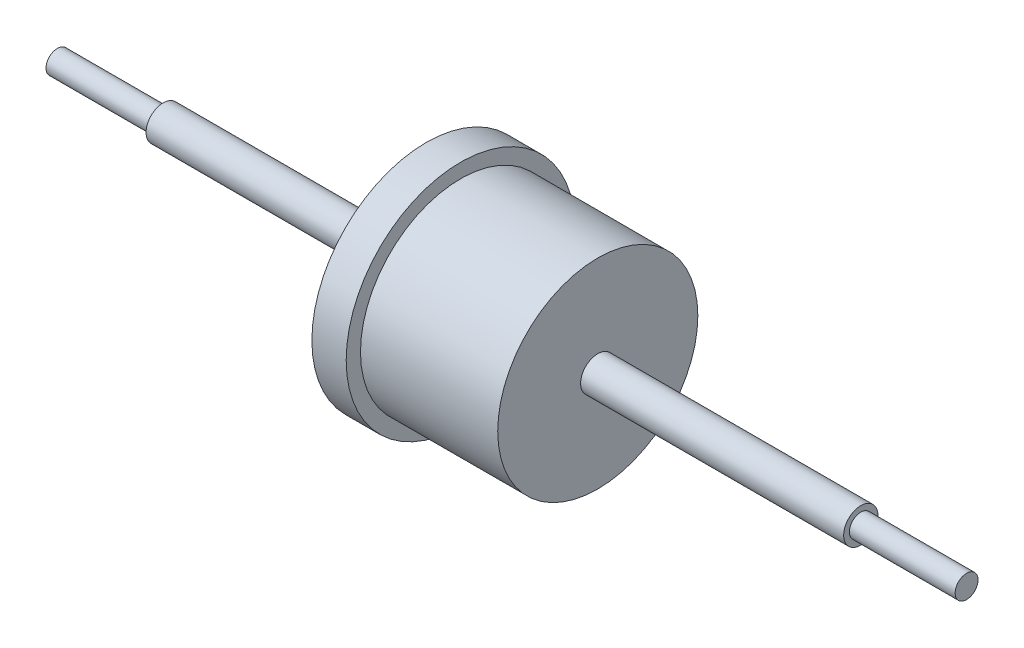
SolidWorks part; units mm, degrees
ref_plane "正面" through (0, 0, 0) normal (0, 0, 1) x (1, 0, 0)
ref_plane "平面" through (0, 0, 0) normal (0, 1, 0) x (1, 0, 0)
ref_plane "右側面" through (0, 0, 0) normal (1, 0, 0) x (0, 0, -1)
body saved out of another part "ｽﾄｯｸ-リア機構部-1"
ref_plane "平面1" through (79.5, 0, 0) normal (1, 0, 0) x (0, 0, -1)
sketch "ｽｹｯﾁ1" plane through (79.5, 0, 0) normal (1, 0, 0) x (0, 0, -1)
  circle A0 centre (300, 0) radius 2 construction
  circle A1 centre (300, 0) radius 2
extrude "ｶｯﾄ - 押し出し1" cut sketch "ｽｹｯﾁ1" along normal through all
mirror "ﾐﾗｰ1" about plane through (0, 0, 0) normal (1, 0, 0) of "ｶｯﾄ - 押し出し1"
